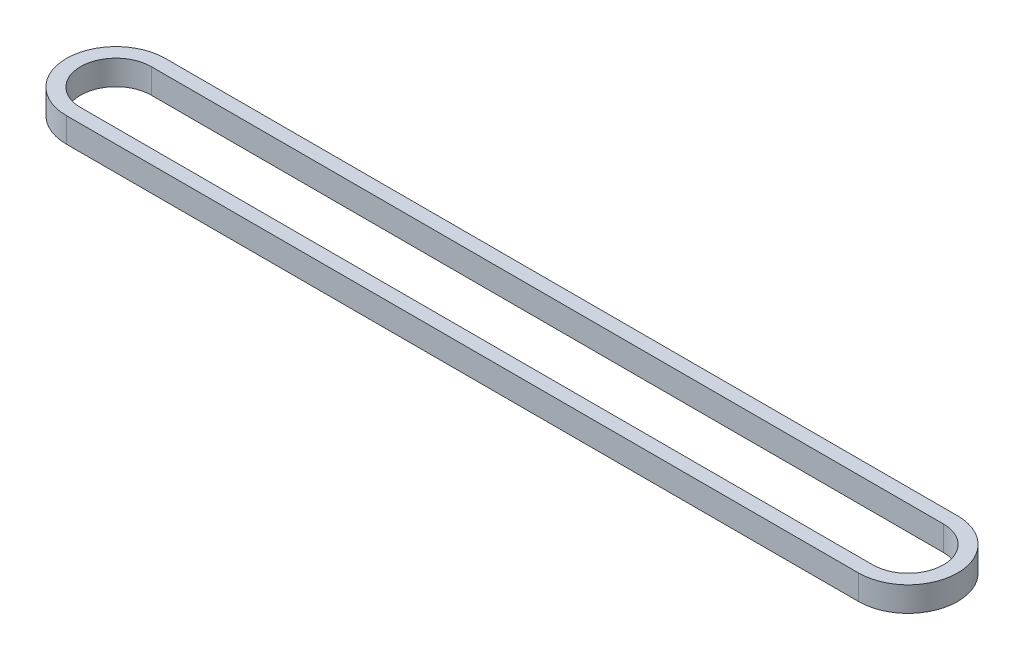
SolidWorks part; units mm, degrees
ref_plane "Front Plane" through (0, 0, 0) normal (0, 0, 1) x (1, 0, 0)
ref_plane "Top Plane" through (0, 0, 0) normal (0, 1, 0) x (1, 0, 0)
ref_plane "Right Plane" through (0, 0, 0) normal (1, 0, 0) x (0, 0, -1)
sketch "Sketch1" plane through (0, 0, 0) normal (0, 1, 0) x (1, 0, 0)
  line L0 (0, 0) -> (-112, 0) construction
  line L1 (0, -5) -> (-112, -5)
  line L2 (0, 5) -> (-112, 5)
  line L4 (0, 0) -> (-112, 0) construction
  line L5 (0, -7) -> (-112, -7)
  line L6 (0, 7) -> (-112, 7)
  arc A0 (0, -5) -> (0, 5) centre (0, 0) ccw
  arc A1 (-112, 5) -> (-112, -5) centre (-112, 0) ccw
  arc A2 (0, -7) -> (0, 7) centre (0, 0) ccw
  arc A3 (-112, 7) -> (-112, -7) centre (-112, 0) ccw
  point P3 (-56, 0)
  point P13 (-56, 0)
  point P18 (-36.0661, 0)
  dimension "D1" = 5
  dimension "D2" = 112
  dimension "D4" = 2
extrude "Boss-Extrude1" add sketch "Sketch1" along normal blind 3.5
